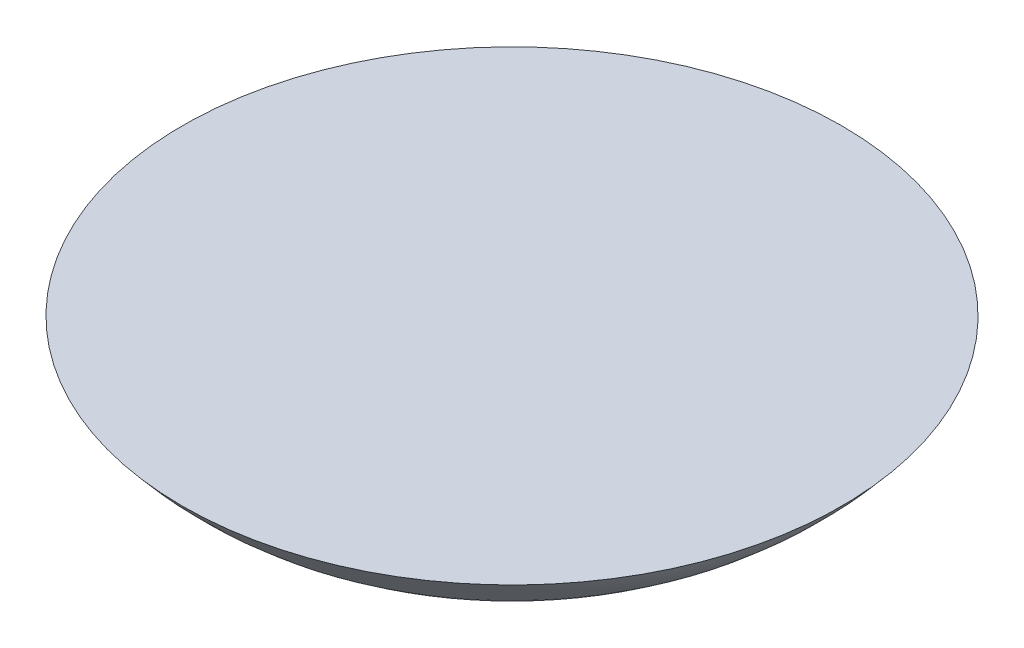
SolidWorks part; units mm, degrees
ref_plane "Plan de face" through (0, 0, 0) normal (0, 0, 1) x (1, 0, 0)
ref_plane "Plan de dessus" through (0, 0, 0) normal (0, 1, 0) x (1, 0, 0)
ref_plane "Plan de droite" through (0, 0, 0) normal (1, 0, 0) x (0, 0, -1)
sketch "Esquisse1" plane through (0, 0, 0) normal (0, 1, 0) x (1, 0, 0)
  circle A0 centre (0, 0) radius 4.5
  dimension "D1" = 9
extrude "Boss.-Extru.3" add sketch "Esquisse1" against normal blind 1.5 contours A0
fillet "Congé4" radius 4 1 edges at (0, -1.5, 4.5)
sketch "Esquisse2" plane through (0, 0, 0) normal (0, 1, 0) x (1, 0, 0)
  line L0 (0, 0) -> (-3.182, -3.182) construction
  circle A0 centre (0, 0) radius 4.5 construction
